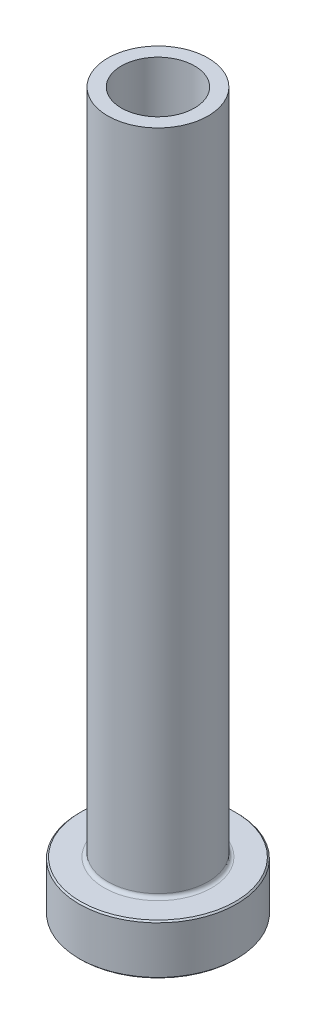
SolidWorks part; units mm, degrees
ref_plane "Front Plane" through (0, 0, 0) normal (0, 0, 1) x (1, 0, 0)
ref_plane "Top Plane" through (0, 0, 0) normal (0, 1, 0) x (1, 0, 0)
ref_plane "Right Plane" through (0, 0, 0) normal (1, 0, 0) x (0, 0, -1)
sketch "Sketch1" plane through (0, 0, 0) normal (0, 0, 1) x (1, 0, 0)
  line L0 (-5.1, 100) -> (-7, 100)
  line L1 (-7, 100) -> (-7, 7)
  line L2 (-7, 7) -> (-11, 7)
  line L3 (-11, 7) -> (-11, 0)
  line L4 (11, 0) -> (-11, 0) construction
  line L5 (-11, 0) -> (-5.35, 0)
  line L6 (-5.1, 45) -> (-5.1, 100)
  line L7 (0, 92.1877) -> (0, -15.5353) construction
  line L8 (0, -11) -> (0, 11) construction
  line L9 (-5.1, 45) -> (-5.35, 33)
  line L10 (-5.35, 33) -> (-5.35, 0)
  dimension "D1" = 0.25
  dimension "ID" = 10.2
  dimension "OD" = 14
  dimension "L" = 100
  dimension "H" = 22
  dimension "T" = 7
  dimension "N" = 55
  dimension "D2" = 12
revolve "Revolve1" add sketch "Sketch1" angle 360 about L7
fillet "Fillet1" radius 0.5 1 edges at (0, 7, 7)
chamfer "Chamfer1" distance 0.2 angle 45 2 edges at (0, 7, 11) (0, 0, 11)
chamfer "Chamfer3" distance 0.5 angle 45 1 edges at (0, 0, 5.35)
